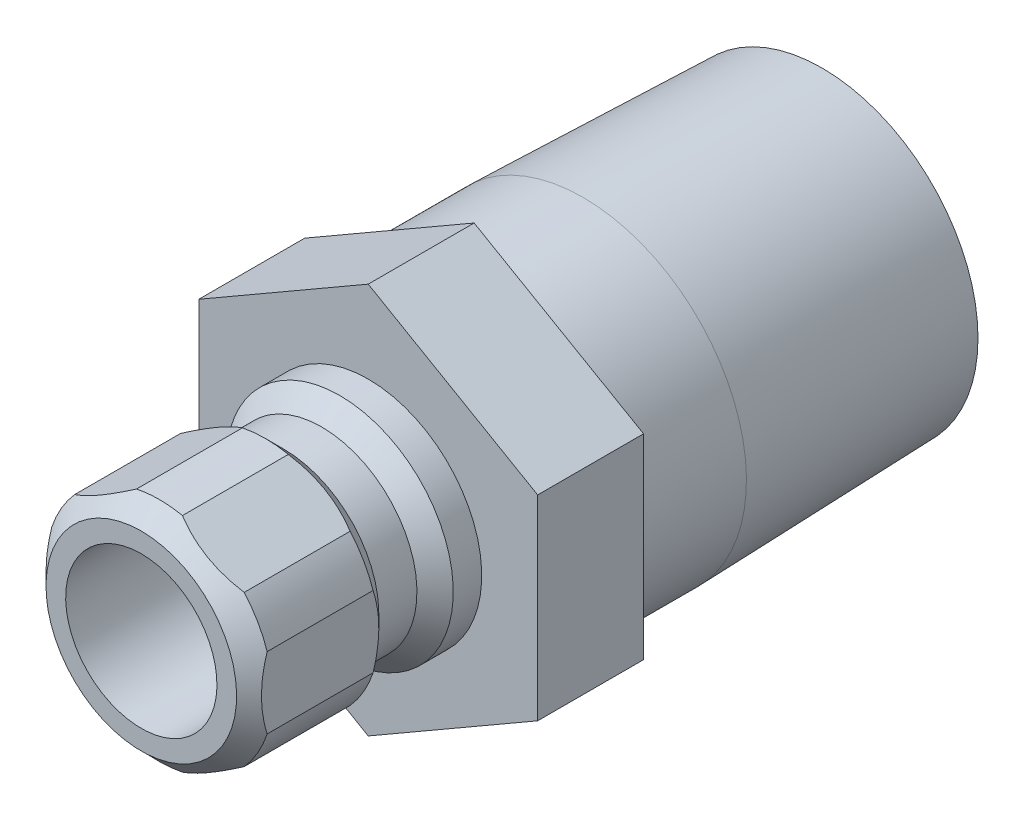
SolidWorks part; units mm, degrees
ref_plane "Front Plane" through (0, 0, 0) normal (0, 0, 1) x (1, 0, 0)
ref_plane "Top Plane" through (0, 0, 0) normal (0, 1, 0) x (1, 0, 0)
ref_plane "Right Plane" through (0, 0, 0) normal (1, 0, 0) x (0, 0, -1)
sketch "Sketch1" plane through (0, 0, 0) normal (1, 0, 0) x (0, 0, -1)
  line L0 (0, 0) -> (-12.7, 0) construction
  line L1 (-9.525, 3.175) -> (-9.525, 4.0005)
  line L2 (-3.556, 4.0005) -> (-3.556, 0) construction
  line L3 (-8.763, 4.7625) -> (-4.318, 4.7625)
  line L4 (0, 6.858) -> (0, 0) construction
  line L5 (-3.556, 4.0005) -> (-1.9558, 4.0005)
  line L6 (-1.1938, 4.7625) -> (0, 4.7625)
  line L7 (0, 4.7625) -> (0, 6.858)
  line L8 (-3.556, 4.0005) -> (-4.318, 4.7625)
  line L9 (-1.9558, 4.0005) -> (-1.1938, 4.7625)
  line L10 (-9.525, 4.0005) -> (-8.763, 4.7625)
  line L11 (-9.525, 3.175) -> (0.127, 3.175)
  line L12 (0, 6.858) -> (9.017, 6.858)
  line L13 (9.017, 6.858) -> (19.05, 6.5445)
  line L14 (19.05, 6.5445) -> (19.05, 4.6228)
  line L15 (0, 0) -> (4.445, 0) construction
  line L16 (0.127, 3.175) -> (0.127, 4.6228)
  line L17 (0.127, 4.6228) -> (19.05, 4.6228)
  dimension "D1" = 9.525
  dimension "D2" = 1.6002
  dimension "D3" = 0.762
  dimension "D4" = 45
  dimension "D5" = 5.969
  dimension "D6" = 45
  dimension "D7" = 1.79
  dimension "D8" = 10.033
  dimension "D9" = 28.575
  dimension "D10" = 3.175
  dimension "D11" = 4.445
  dimension "D12" = 6.35
  dimension "D13" = 9.652
  dimension "D14" = 9.525
  dimension "D15" = 13.716
  dimension "D16" = 9.2456
revolve "Revolve1" add sketch "Sketch1" angle 360 about L0
sketch "Sketch2" plane through (0, 0, 0) normal (0, 0, 1) x (1, 0, 0)
  line L1 (-7.112, 4.1061) -> (-7.112, -4.1061)
  line L2 (-7.112, -4.1061) -> (0, -8.2122)
  line L3 (0, -8.2122) -> (7.112, -4.1061)
  line L4 (7.112, -4.1061) -> (7.112, 4.1061)
  line L5 (7.112, 4.1061) -> (0, 8.2122)
  line L6 (0, 8.2122) -> (-7.112, 4.1061)
  circle A0 centre (0, 0) radius 7.112 construction
  circle A1 centre (0, 0) radius 3.175 construction
  circle A2 centre (0, 0) radius 3.175
  dimension "D1" = 14.224
extrude "Boss-Extrude1" add sketch "Sketch2" against normal up to vertex (4.445 mm away)
sketch "Sketch3" plane through (0, 0, 0) normal (0, 0, 1) x (1, 0, 0)
  line L1 (-4.5212, 2.6103) -> (-4.5212, -2.6103)
  line L2 (-4.5212, -2.6103) -> (0, -5.2206)
  line L3 (0, -5.2206) -> (4.5212, -2.6103)
  line L4 (4.5212, -2.6103) -> (4.5212, 2.6103)
  line L5 (4.5212, 2.6103) -> (0, 5.2206)
  line L6 (0, 5.2206) -> (-4.5212, 2.6103)
  circle A0 centre (0, 0) radius 4.5212 construction
  dimension "D1" = 9.0424
extrude "Cut-Extrude1" cut sketch "Sketch3" along normal through all from vertex at 3.556 flip side to cut
